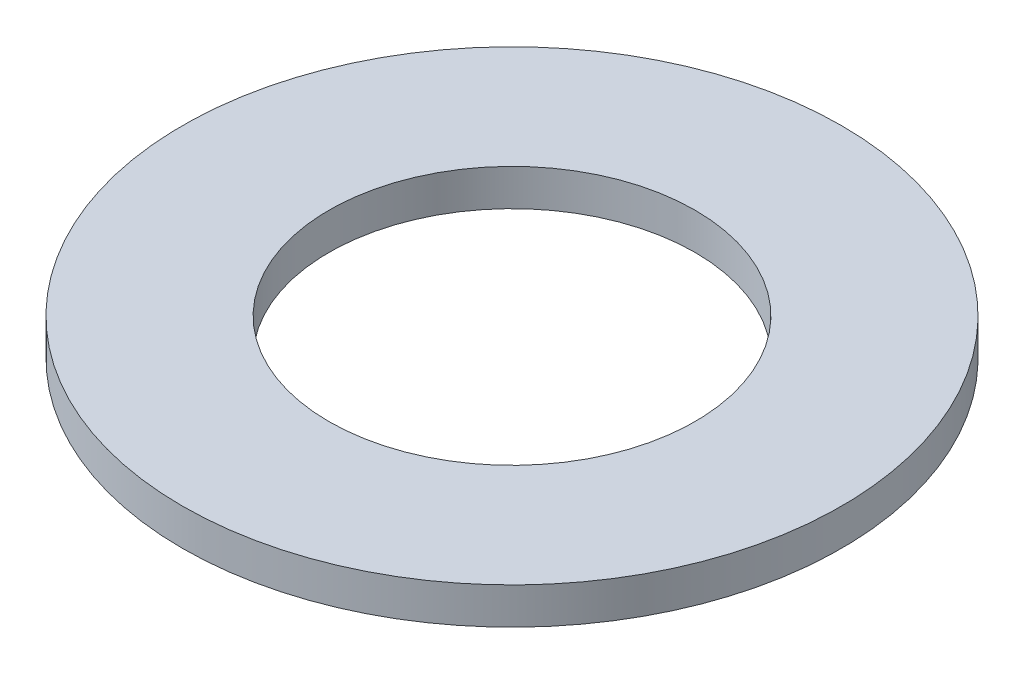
SolidWorks part; units mm, degrees
ref_plane "Front Plane" through (0, 0, 0) normal (0, 0, 1) x (1, 0, 0)
ref_plane "Top Plane" through (0, 0, 0) normal (0, 1, 0) x (1, 0, 0)
ref_plane "Right Plane" through (0, 0, 0) normal (1, 0, 0) x (0, 0, -1)
sketch "Sketch1" plane through (0, 0, 0) normal (0, 1, 0) x (1, 0, 0)
  circle A0 centre (0, 0) radius 9
  circle A1 centre (0, 0) radius 5
  dimension "D1" = 18
  dimension "D2" = 10
extrude "Boss-Extrude1" add sketch "Sketch1" along normal blind 1
